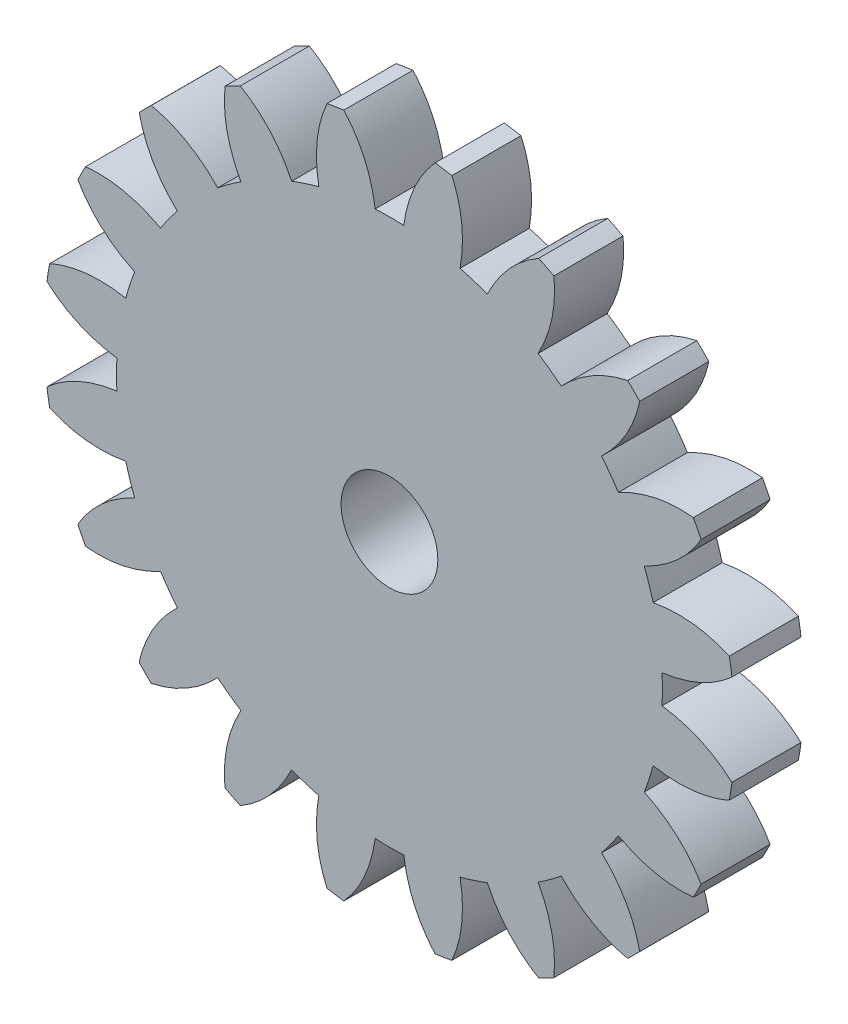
SolidWorks part; units mm, degrees
ref_plane "前基準面" through (0, 0, 0) normal (0, 0, 1) x (1, 0, 0)
ref_plane "上基準面" through (0, 0, 0) normal (0, 1, 0) x (1, 0, 0)
ref_plane "右基準面" through (0, 0, 0) normal (1, 0, 0) x (0, 0, -1)
sketch "草圖1" plane through (0, 0, 0) normal (0, 0, 1) x (1, 0, 0)
  line L0 (0, 0) -> (0, 50) construction
  line L1 (0, 0) -> (7.8217, 49.3844) construction
  line L2 (0, 0) -> (-7.8217, 49.3844) construction
  line L3 (0, 0) -> (2.0673, 39.4459) construction
  line L4 (0, 0) -> (-2.0673, 39.4459) construction
  line L5 (-6.6046, 49.5619) -> (-7.8217, 49.3844)
  line L6 (6.6046, 49.5619) -> (7.8217, 49.3844)
  circle A0 centre (0, 0) radius 7
  circle A1 centre (0, 0) radius 39.5
  circle A2 centre (0, 0) radius 45 construction
  circle A3 centre (0, 0) radius 50 construction
  spline S0 degree 2 poles (-2.0673, 39.4459) (-2.884, 45.4275) (-6.6046, 49.5619) knots 0 0 0 1 1 1
  spline S1 degree 2 poles (2.0673, 39.4459) (2.884, 45.4275) (6.6046, 49.5619) knots 0 0 0 1 1 1
  dimension "D1" = 100
  dimension "D2" = 90
  dimension "D3" = 79
  dimension "D4" = 14
  dimension "D5" = 9
  dimension "D7" = 6
  dimension "D8" = 1.23
sketch "草圖2" plane through (0, 0, 0) normal (0, 0, 1) x (1, 0, 0)
  line L0 (0, 63) -> (0, 50) construction
  line L1 (0, 63) -> (-6.8883, 46.3702) construction
  line L2 (0, 63) -> (6.8883, 46.3702) construction
  line L3 (0, 63) -> (-3.4455, 50.9842) construction
  line L4 (0, 63) -> (3.4455, 50.9842) construction
  line L5 (-1.625, 40) -> (1.625, 40)
  line L7 (0, 0) -> (0, 50) construction
  circle A0 centre (0, 63) radius 5
  circle A1 centre (0, 0) radius 7 construction
  circle A2 centre (0, 63) radius 12.5
  circle A3 centre (0, 63) radius 18 construction
  circle A4 centre (0, 0) radius 45 construction
  spline S0 degree 2 poles (-1.625, 40) (-4.1616, 45.4635) (-3.4455, 50.9842) knots 0 0 0 1 1 1
  spline S1 degree 2 poles (1.625, 40) (4.1616, 45.4635) (3.4455, 50.9842) knots 0 0 0 1 1 1
  point P17 (0, 40)
  dimension "D1" = 63
  dimension "D2" = 10
  dimension "D3" = 25
  dimension "D4" = 45
  dimension "D5" = 22.5
  dimension "D6" = 32
  dimension "D7" = 3.25
  dimension "D8" = 23
sketch "草圖3" plane through (0, 0, 0) normal (0, 0, 1) x (1, 0, 0)
  circle A0 centre (0, 0) radius 39.5 construction
  arc A1 (2.0673, 39.4459) -> (-2.0673, 39.4459) centre (0, 0) ccw
  arc A2 (14.1555, 36.8764) -> (10.2234, 38.1541) centre (0, 0) ccw
  arc A3 (24.8582, 30.6973) -> (21.5132, 33.1275) centre (0, 0) ccw
  arc A4 (33.1275, 21.5132) -> (30.6973, 24.8582) centre (0, 0) ccw
  arc A5 (38.1541, 10.2234) -> (36.8764, 14.1555) centre (0, 0) ccw
  arc A6 (39.4459, -2.0673) -> (39.4459, 2.0673) centre (0, 0) ccw
  arc A7 (36.8764, -14.1555) -> (38.1541, -10.2234) centre (0, 0) ccw
  arc A8 (30.6973, -24.8582) -> (33.1275, -21.5132) centre (0, 0) ccw
  arc A9 (21.5132, -33.1275) -> (24.8582, -30.6973) centre (0, 0) ccw
  arc A10 (10.2234, -38.1541) -> (14.1555, -36.8764) centre (0, 0) ccw
  arc A11 (-2.0673, -39.4459) -> (2.0673, -39.4459) centre (0, 0) ccw
  arc A12 (-14.1555, -36.8764) -> (-10.2234, -38.1541) centre (0, 0) ccw
  arc A13 (-24.8582, -30.6973) -> (-21.5132, -33.1275) centre (0, 0) ccw
  arc A14 (-33.1275, -21.5132) -> (-30.6973, -24.8582) centre (0, 0) ccw
  arc A15 (-38.1541, -10.2234) -> (-36.8764, -14.1555) centre (0, 0) ccw
  arc A16 (-39.4459, 2.0673) -> (-39.4459, -2.0673) centre (0, 0) ccw
  arc A17 (-36.8764, 14.1555) -> (-38.1541, 10.2234) centre (0, 0) ccw
  arc A18 (-30.6973, 24.8582) -> (-33.1275, 21.5132) centre (0, 0) ccw
  arc A19 (-21.5132, 33.1275) -> (-24.8582, 30.6973) centre (0, 0) ccw
  arc A20 (-10.2234, 38.1541) -> (-14.1555, 36.8764) centre (0, 0) ccw
  circle A21 centre (0, 0) radius 50 construction
  arc A22 (-21.5968, 45.0952) -> (-23.7885, 43.9785) centre (0, 0) ccw
  arc A23 (-6.6046, 49.5619) -> (-9.0341, 49.1771) centre (0, 0) ccw
  arc A24 (9.0341, 49.1771) -> (6.6046, 49.5619) centre (0, 0) ccw
  arc A25 (23.7885, 43.9785) -> (21.5968, 45.0952) centre (0, 0) ccw
  arc A26 (36.2143, 34.475) -> (34.475, 36.2143) centre (0, 0) ccw
  arc A27 (45.0952, 21.5968) -> (43.9785, 23.7885) centre (0, 0) ccw
  arc A28 (49.5619, 6.6046) -> (49.1771, 9.0341) centre (0, 0) ccw
  arc A29 (49.1771, -9.0341) -> (49.5619, -6.6046) centre (0, 0) ccw
  arc A30 (43.9785, -23.7885) -> (45.0952, -21.5968) centre (0, 0) ccw
  arc A31 (34.475, -36.2143) -> (36.2143, -34.475) centre (0, 0) ccw
  arc A32 (21.5968, -45.0952) -> (23.7885, -43.9785) centre (0, 0) ccw
  arc A33 (6.6046, -49.5619) -> (9.0341, -49.1771) centre (0, 0) ccw
  arc A34 (-9.0341, -49.1771) -> (-6.6046, -49.5619) centre (0, 0) ccw
  arc A35 (-23.7885, -43.9785) -> (-21.5968, -45.0952) centre (0, 0) ccw
  arc A36 (-36.2143, -34.475) -> (-34.475, -36.2143) centre (0, 0) ccw
  arc A37 (-45.0952, -21.5968) -> (-43.9785, -23.7885) centre (0, 0) ccw
  arc A38 (-49.5619, -6.6046) -> (-49.1771, -9.0341) centre (0, 0) ccw
  arc A39 (-49.1771, 9.0341) -> (-49.5619, 6.6046) centre (0, 0) ccw
  arc A40 (-43.9785, 23.7885) -> (-45.0952, 21.5968) centre (0, 0) ccw
  arc A41 (-34.475, 36.2143) -> (-36.2143, 34.475) centre (0, 0) ccw
  circle A42 centre (0, 0) radius 7
  parabola Q0 construction
  parabola Q1 construction
  parabola Q2
  parabola Q3
  parabola Q4
  parabola Q5
  parabola Q6
  parabola Q7
  parabola Q8
  parabola Q9
  parabola Q10
  parabola Q11
  parabola Q12
  parabola Q13
  parabola Q14
  parabola Q15
  parabola Q16
  parabola Q17
  parabola Q18
  parabola Q19
  parabola Q20
  parabola Q21
  parabola Q22
  parabola Q23
  parabola Q24
  parabola Q25
  parabola Q26
  parabola Q27
  parabola Q28
  parabola Q29
  parabola Q30
  parabola Q31
  parabola Q32
  parabola Q33
  parabola Q34
  parabola Q35
  parabola Q36
  parabola Q37
  parabola Q38
  parabola Q39
  parabola Q40
  parabola Q41
  point P169 (0, 0)
  dimension "D2" = 14
  dimension "D1" = 20
extrude "填料-伸長1" add sketch "草圖3" along normal mid plane 10
